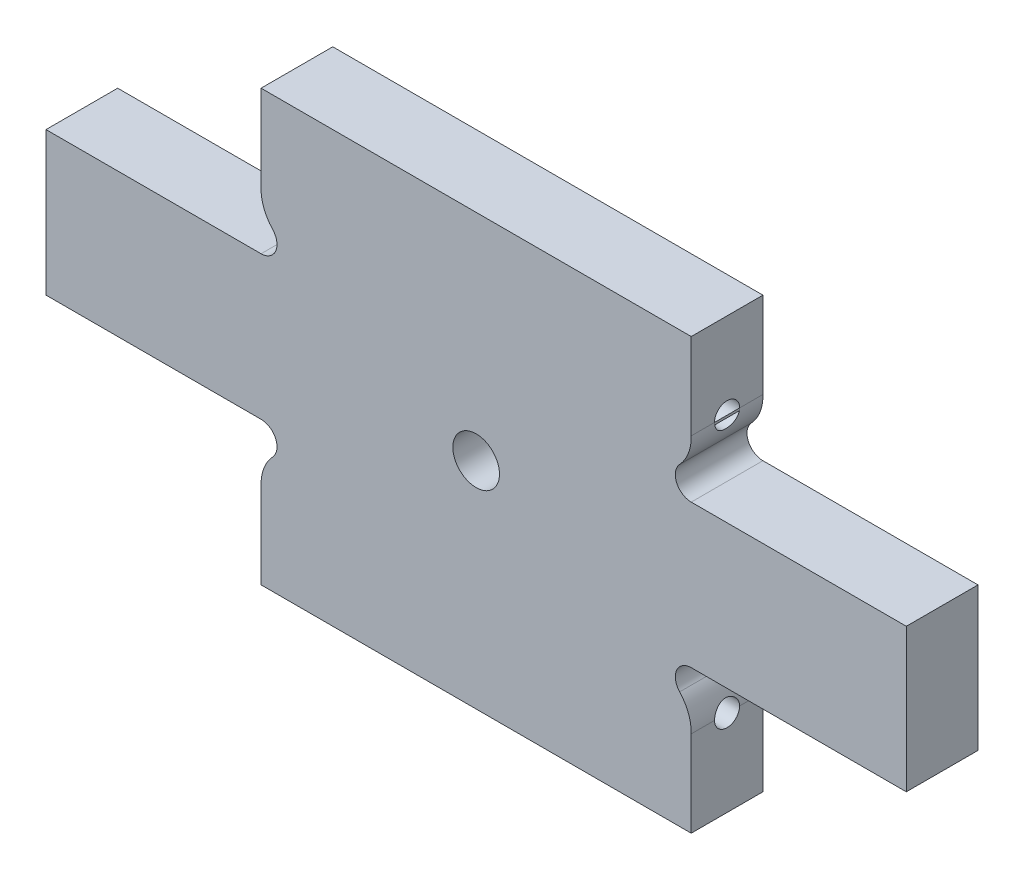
SolidWorks part; units mm, degrees
ref_plane "Plan de face" through (0, 0, 0) normal (0, 0, 1) x (1, 0, 0)
ref_plane "Plan de dessus" through (0, 0, 0) normal (0, 1, 0) x (1, 0, 0)
ref_plane "Plan de droite" through (0, 0, 0) normal (1, 0, 0) x (0, 0, -1)
sketch "Esquisse1" plane through (0, 0, 0) normal (0, 0, 1) x (1, 0, 0)
  line L6 (30, -10) -> (60, -10)
  line L7 (60, -10) -> (60, 10)
  line L8 (60, 10) -> (30, 10)
  line L10 (30, 30) -> (-30, 30)
  line L11 (-30, 30) -> (-30, 18)
  line L12 (-30, 10) -> (-60, 10)
  line L13 (-60, 10) -> (-60, -10)
  line L14 (-60, -10) -> (-30, -10)
  line L15 (-29.9978, -18) -> (-29.9978, -30)
  line L16 (-29.9978, -30) -> (29.9978, -30)
  line L17 (29.9978, -30) -> (29.9978, -18)
  line L18 (0, -55) -> (0, 55) construction
  line L19 (30, 30) -> (30, 18)
  arc A0 (29.9978, -18) -> (28.3796, -13.7374) centre (24, -17.8386) ccw
  arc A1 (30, -10) -> (28.3796, -13.7374) centre (30, -12.22) ccw
  arc A4 (-30, 18) -> (-28.3796, 13.7374) centre (-24.0021, 17.8408) ccw
  arc A5 (-30, 10) -> (-28.3796, 13.7374) centre (-30, 12.22) ccw
  arc A6 (-28.3796, -13.7374) -> (-30, -10) centre (-30, -12.22) ccw
  arc A7 (-28.3796, -13.7374) -> (-29.9978, -18) centre (-24, -17.8386) ccw
  arc A8 (30, 10) -> (28.3796, 13.7374) centre (30, 12.22) cw
  arc A9 (30, 18) -> (28.3796, 13.7374) centre (24.0021, 17.8408) cw
  dimension "D1" = 60
  dimension "D2" = 20
  dimension "D3" = 20
  dimension "D4" = 30
  dimension "D5" = 12
  dimension "D6" = 30
  dimension "D7" = 10
  dimension "D8" = 10
  dimension "D9" = 12
  dimension "D10" = 12
  dimension "D11" = 30
  dimension "D12" = 30
extrude "Boss.-Extru.1" add sketch "Esquisse1" along normal blind 10
sketch "Esquisse2" plane through (0, 0, 10) normal (0, 0, 1) x (1, 0, 0)
  circle A0 centre (0, 0) radius 3.25
  dimension "D1" = 6.5
extrude "Enlèv. mat.-Extru.1" cut sketch "Esquisse2" against normal blind 10
hole_wizard "Diamètre du perçage Ø3.5 (3.5)1" positions "Esquisse3" profile "Esquisse4" hole size "Ø3.5" standard "ISO"
sketch "Esquisse3" plane through (30, 0, 0) normal (1, 0, 0) x (0, 0, -1)
  line L1 (0, 18) -> (0, 30) construction
  line L2 (0, -30) -> (0, -18) construction
  point P0 (-5, 18)
  point P2 (-5, -18)
  point P10 (14.6987, -12.1701)
  dimension "D1" = 18
  dimension "D2" = 18
  dimension "D3" = 5
  dimension "D4" = 5
sketch "Esquisse4" plane through (30, 18, 5) normal (0, 1, 0) x (0, 0, -1)
  line L0 (0, 0) -> (0, 15.0515)
  line L1 (0, 15.0515) -> (1.75, 14)
  line L2 (1.75, 14) -> (1.75, 0)
  line L5 (1.75, 0) -> (0, 0)
  line L10 (0, 15.0515) -> (-1.75, 14) construction
  line L11 (0, -6.35) -> (0, 107.95) construction
  dimension "Diamètre du perçage" = 3.5
  dimension "Profondeur du perçage" = 14
  dimension "Angle de pointe" = 118
mirror "Symétrie1" about plane through (0, 0, 0) normal (1, 0, 0) of "Diamètre du perçage Ø3.5 (3.5)1"
